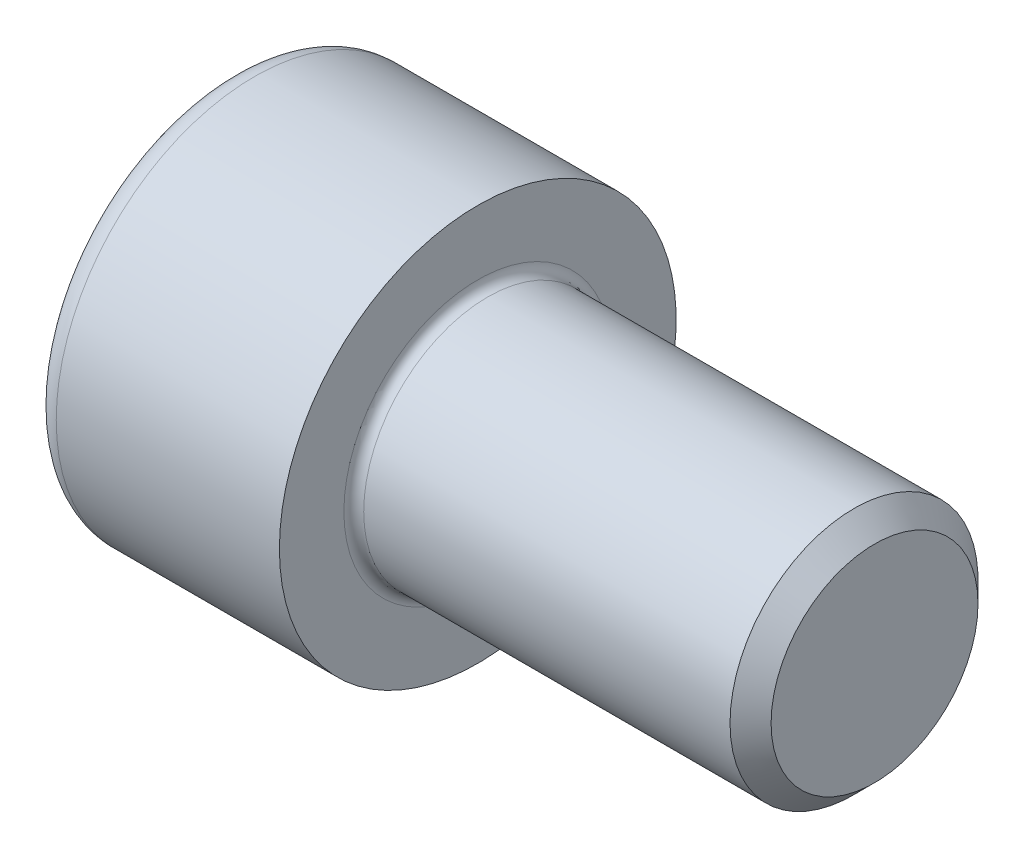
SolidWorks part; units mm, degrees
revolve "Base-Revolve" add sketch "BodySke"
sketch "BodySke" plane through (0, 0, 0) normal (0, 0, 1) x (1, 0, 0)
  line L0 (0, 0) -> (0, 8)
  line L1 (0, 8) -> (10, 8)
  line L2 (10, 8) -> (10, 5)
  line L3 (10, 5) -> (25.172, 5)
  line L4 (26, 4.172) -> (26, 0)
  line L5 (26, 0) -> (0, 0)
  line L6 (-31.75, 0) -> (127, 0) construction
  line L8 (26, 4.172) -> (25.172, 5)
  line L10 (26, -4.172) -> (25.172, -5) construction
  line L11 (11.5, 9.525) -> (11.5, 3.175) construction
  line L12 (10, 9.525) -> (10, 3.175) construction
  line L13 (-34, 9.525) -> (-34, 3.175) construction
fillet "Fillet1" radius 0.4 1 edges at (10, 0, 5)
fillet "Fillet2" radius 1 1 edges at (0, 0, 8)
ref_plane "Plane1" through (0, 0, 0) normal (0, 0, 1) x (1, 0, 0)
ref_plane "Plane2" through (0, 0, 0) normal (0, 1, 0) x (1, 0, 0)
ref_plane "Plane3" through (0, 0, 0) normal (1, 0, 0) x (0, 0, -1)
sketch "Sketch2" plane through (0, 0, 0) normal (0, 0, 1) x (1, 0, 0)
  line L0 (0, 4.0125) -> (5, 4.0125)
  line L1 (5, 4.0125) -> (7.3166, 0)
  line L2 (-31.75, 0) -> (127, 0) construction
  line L3 (7.3166, 0) -> (0, 0)
  line L4 (0, 0) -> (0, 4.0125)
  line L6 (0, 0) -> (47.625, 0) construction
revolve "Hex-PreBroach" cut sketch "Sketch2" angle 360 about L6
sketch "Sketch3" plane through (0, 0, 0) normal (-1, 0, 0) x (0, 0.5, 0.866)
  line L0 (2.3166, 4.0125) -> (-2.3166, 4.0125)
  line L1 (-2.3166, 4.0125) -> (-4.6332, 0)
  line L2 (2.3166, 4.0125) -> (4.6332, 0)
  line L3 (2.3166, -4.0125) -> (4.6332, 0)
  line L4 (2.3166, -4.0125) -> (-2.3166, -4.0125)
  line L5 (-2.3166, -4.0125) -> (-4.6332, 0)
extrude "Hex" cut sketch "Sketch3" against normal blind 5
sketch "ThdSchSke" plane through (0, 0, 0) normal (0, 0, 1) x (1, 0, 0)
  line L0 (14.5, -4.172) -> (13.9202, -5)
  line L1 (14.5, -4.172) -> (15.0798, -5)
  line L2 (15.0798, -5) -> (15.0798, -6.25)
  line L3 (-3.175, 0) -> (5.1513, 0) construction
  line L4 (0, 7) -> (0, -7) construction
  line L5 (15.0798, -6.25) -> (13.9202, -6.25)
  line L6 (13.9202, -6.25) -> (13.9202, -5)
revolve "ThreadSchematic" [suppressed] cut sketch "ThdSchSke" angle 360 about L3
pattern_linear "ThdSchPat" [suppressed]
equation "\"D2@Sketch3\" = \"Hex_size@Sketch3\" / 2"
equation "\"D1@Sketch3\" = \"Hex_size@Sketch3\" / 2"
equation "\"D1@Sketch2\" = \"Hex_size@Sketch3\" / 2"
equation "\"Thread_minor@ThreadCosmetic\"  =  \"Minor_dia@BodySke\""
equation "\"Depth@Sketch2\" =  \"Key_eng@Hex\""
equation "\"Thread_length@ThreadCosmetic\" = ((sgn( (\"Length@BodySke\" - \"Advance@BodySke\" * 3.0) - \"Thread_nom@BodySke\" )-1)*( (\"Length@BodySke\" - \"Advance@BodySke\" * 3.0) - \"Thread_nom@BodySke\" ))/-2+ \"Thread_no"
equation "\"Thread_minor@ThdSchSke\" = \"Minor_dia@BodySke\""
equation "\"Diameter@ThdSchSke\" = \"Diameter@BodySke\""
equation "\"Overcut@ThdSchSke\" = \"Diameter@BodySke\" * 1.25"
equation "\"Start@ThdSchSke\" = \"Head_ht@BodySke\" + \"Length@BodySke\" - \"Thread_length@ThreadCosmetic\"  '---Non-countersunk---"
equation "\"Num_threads@ThdSchPat\" = int( \"Thread_length@ThreadCosmetic\" / \"Advance@BodySke\" + 0.999 )  + 1"
equation "\"Advance@ThdSchPat\" = \"Thread_length@ThreadCosmetic\" /  (\"Num_threads@ThdSchPat\" - 1) 'relax it"
equation "\"Num_threads@ThdSchPat\" = \"Num_threads@ThdSchPat\" - sgn( \"Num_threads@ThdSchPat\" - 1) '---chamfered tips only---"
